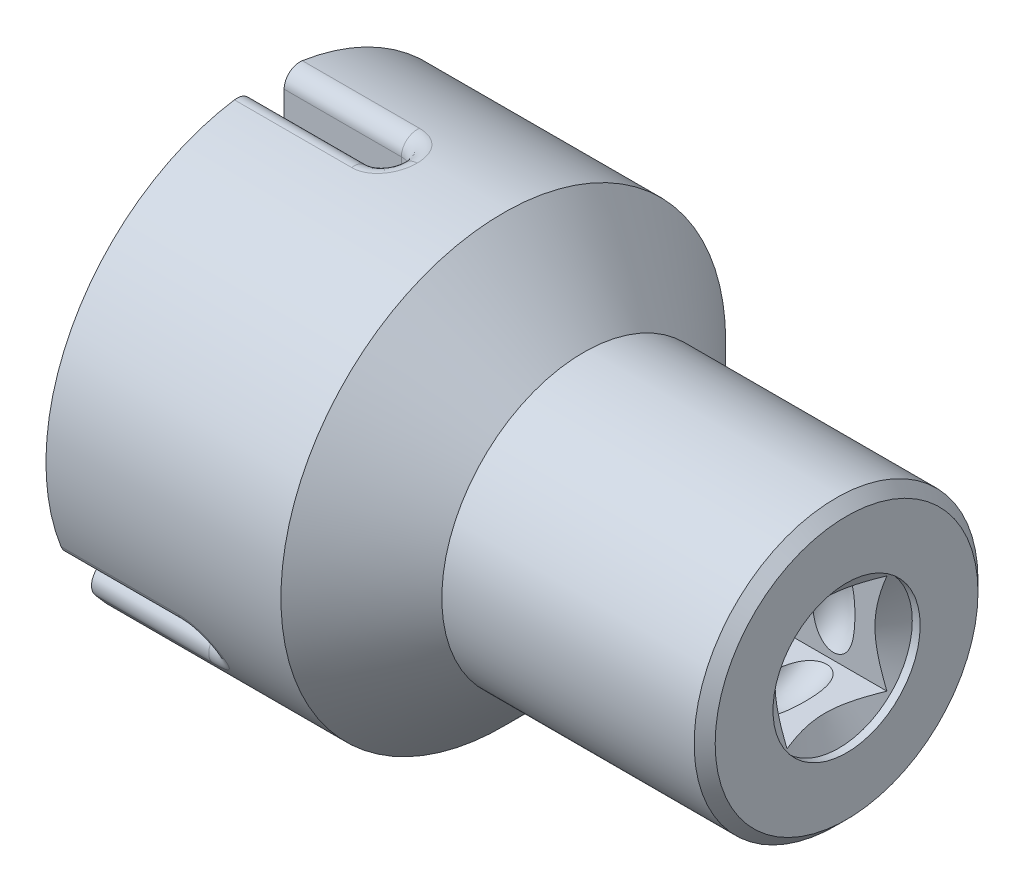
SolidWorks part; units mm, degrees
ref_plane "Plan de face" through (0, 0, 0) normal (0, 0, 1) x (1, 0, 0)
ref_plane "Plan de dessus" through (0, 0, 0) normal (0, 1, 0) x (1, 0, 0)
ref_plane "Plan de droite" through (0, 0, 0) normal (1, 0, 0) x (0, 0, -1)
sketch "Esquisse1" plane through (0, 0, 0) normal (0, 0, 1) x (1, 0, 0)
  line L0 (229.8097, 0) -> (67.6269, 0) construction
  line L1 (197.2, 27) -> (197.2, 14)
  line L2 (192.8132, 9) -> (195.7, 14)
  line L3 (100.5, 44.3056) -> (75.5, 44.3056) construction
  line L4 (192.8132, 9) -> (140.6555, 9)
  line L5 (87.2, 32.3056) -> (87.2, 42.3056)
  line L6 (87.2, 42.3056) -> (131.8944, 42.3056)
  line L8 (197.2, 27) -> (147.2, 27)
  line L9 (201.7, 27) -> (197.2, 27) construction
  line L10 (195.7, 14) -> (197.2, 14)
  line L11 (147.2, 27) -> (131.8944, 42.3056)
  line L12 (117.2, -51) -> (117.2, 51) construction
  line L13 (197.2, 27) -> (197.2, -27) construction
  line L16 (87.2, 32.3056) -> (121.4265, 32.3056)
  line L17 (130.0868, 27.3056) -> (140.6555, 9)
  arc A0 (121.4265, 32.3056) -> (130.0868, 27.3056) centre (121.4265, 22.3056) cw
  point P21 (127.2, 32.3056)
  dimension "D8" = 10
  dimension "D2" = 30
  dimension "D3" = 50
  dimension "D4" = 45
  dimension "D5" = 60
  dimension "D6" = 10
  dimension "D7" = 40
  dimension "D9" = 28
  dimension "D10" = 18
  dimension "D11" = 60
  dimension "D12" = 1.5
  dimension "D13" = 2
revolve "Révolution1" add sketch "Esquisse1" angle 360 about L0
sketch "Esquisse2" plane through (197.2, 0, 0) normal (1, 0, 0) x (0, 0, -1)
  line L1 (-9.5, 9.5) -> (9.5, 9.5)
  line L2 (-9.5, 9.5) -> (-9.5, -9.5)
  line L3 (-9.5, -9.5) -> (9.5, -9.5)
  line L4 (9.5, 9.5) -> (9.5, -9.5)
  line L5 (-9.5, 9.5) -> (9.5, -9.5) construction
  line L6 (-9.5, -9.5) -> (9.5, 9.5) construction
  point P0 (0, 0)
  dimension "D1" = 19
extrude "Enlèv. mat.-Extru.1" cut sketch "Esquisse2" against normal up to next
fillet "Congé4" [suppressed] radius 3
chamfer "Chanfrein1" distance 2 angle 45 1 edges at (197.2, 0, -27)
sketch "Esquisse3" plane through (87.2, 0, 0) normal (-1, 0, 0) x (0, 0, 1)
  line L0 (0, 0) -> (0, 32.3056) construction
  line L1 (3, 42.1991) -> (3, 32.166)
  line L2 (0, 0) -> (27.9775, -16.1528) construction
  line L3 (-3, 42.1991) -> (-3, 32.166)
  line L5 (0, 0) -> (-27.9775, -16.1528) construction
  line L6 (-38.0455, -18.5015) -> (-29.3566, -13.4849)
  line L7 (29.3566, -13.4849) -> (38.0455, -18.5015)
  line L8 (26.3566, -18.6811) -> (35.0455, -23.6976)
  line L10 (-35.0455, -23.6976) -> (-26.3566, -18.6811)
  circle A0 centre (0, 0) radius 42.3056 construction
  circle A1 centre (0, 0) radius 32.3056 construction
  arc A2 (-38.0455, -18.5015) -> (-35.0455, -23.6976) centre (0, 0) ccw
  arc A3 (-29.3566, -13.4849) -> (-26.3566, -18.6811) centre (0, 0) ccw
  arc A4 (26.3566, -18.6811) -> (29.3566, -13.4849) centre (0, 0) ccw
  arc A5 (35.0455, -23.6976) -> (38.0455, -18.5015) centre (0, 0) ccw
  arc A6 (3, 42.1991) -> (-3, 42.1991) centre (0, 0) ccw
  arc A7 (3, 32.166) -> (-3, 32.166) centre (0, 0) ccw
  dimension "D1" = 120
  dimension "D2" = 6
  dimension "D3" = 6
  dimension "D4" = 6
extrude "Enlèv. mat.-Extru.2" cut sketch "Esquisse3" against normal up to vertex
fillet "Congé1" radius 3 6 edges at (112.5, 37.1825, -3) (112.5, 37.1825, 3) (112.5, -21.1893, -30.701) (112.5, -15.9932, -33.701) (112.5, -21.1893, 30.701) (112.5, -15.9932, 33.701)
fillet "Congé2" radius 3 12 edges at (98.35, -18.5015, -38.0455) (111.8447, -19.5114, -37.5375) (111.3714, -23.1509, -35.409) (98.35, -23.6976, 35.0455) (111.8447, -22.7528, 35.6661) (111.3714, -19.0897, 37.7538) (98.35, 42.1991, 3) (111.8447, 42.2642, 1.8714) (111.3714, 42.2406, -2.3448) (98.35, -23.6976, -35.0455) (98.35, -18.5015, 38.0455) (98.35, 42.1991, -3)
sketch "Esquisse4" plane through (0, 0, 0) normal (0, 0, 1) x (1, 0, 0)
  line L0 (197.2, -25) -> (197.2, 25) construction
  line L2 (174.4011, 0) -> (207.5175, 0) construction
  circle A0 centre (185.2, 8.3) radius 4.25
  dimension "D2" = 8.5
  dimension "D1" = 12
  dimension "D3" = 8.3
revolve "Enlèvement de matière-Révolution1" cut sketch "Esquisse4" angle 360 about L2
